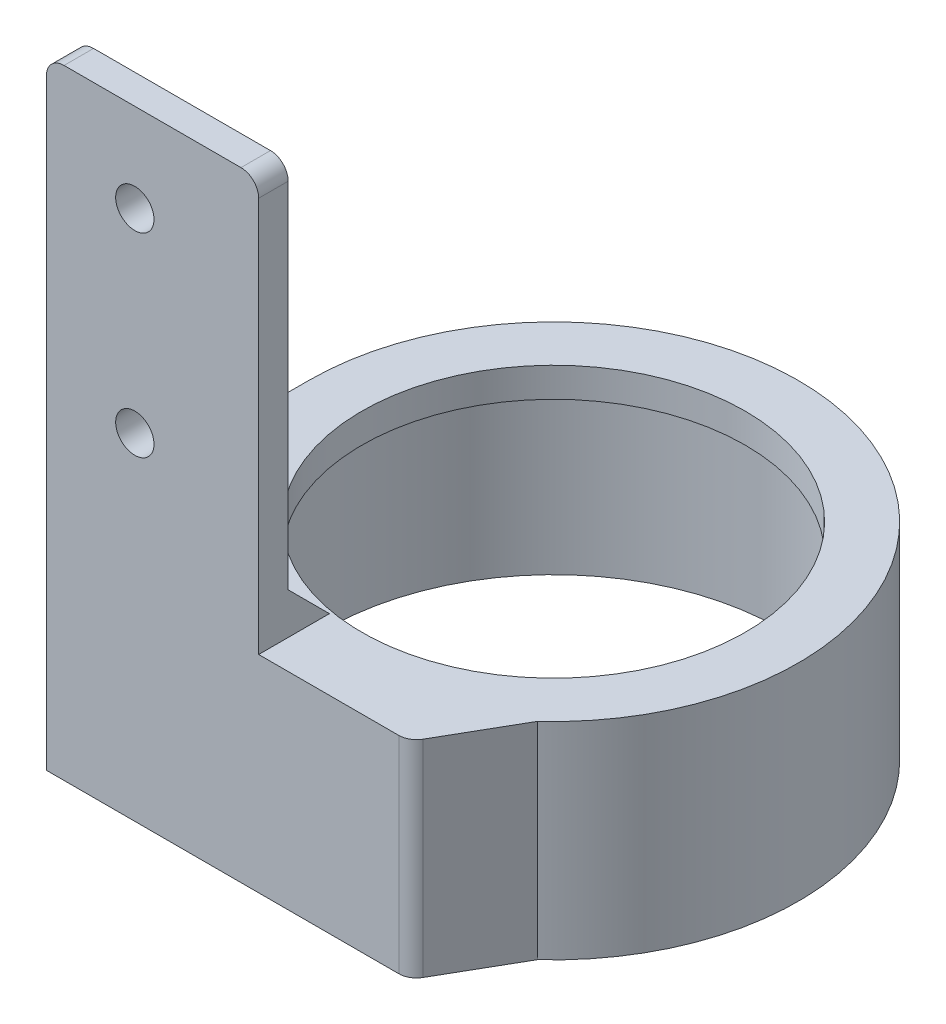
SolidWorks part; units mm, degrees
ref_plane "Ebene vorne" through (0, 0, 0) normal (0, 0, 1) x (1, 0, 0)
ref_plane "Ebene oben" through (0, 0, 0) normal (0, 1, 0) x (1, 0, 0)
ref_plane "Ebene rechts" through (0, 0, 0) normal (1, 0, 0) x (0, 0, -1)
sketch "Skizze1" plane through (0, 0, 0) normal (0, 0, 1) x (1, 0, 0)
  line L0 (18, 0) -> (18, -105) construction
  line L1 (3, 0) -> (33, 0)
  line L2 (0, -3) -> (0, -97)
  line L3 (3, -105) -> (33, -105)
  line L4 (36, -3) -> (36, -97)
  line L5 (0, -63) -> (36, -63) construction
  line L6 (33, -105) -> (36, -105)
  line L7 (36, -105) -> (36, -97)
  line L8 (0, -97) -> (0, -105)
  line L9 (0, -105) -> (3, -105)
  circle A2 centre (15, -15) radius 3.25
  circle A3 centre (15, -48) radius 3.25
  arc A6 (3, 0) -> (0, -3) centre (3, -3) ccw
  arc A7 (33, 0) -> (36, -3) centre (33, -3) cw
  point P18 (36, -105)
  point P21 (0, 0)
  point P24 (36, 0)
  dimension "D3" = 15
  dimension "D4" = 15
  dimension "D5" = 6.5
  dimension "D6" = 6.5
  dimension "D7" = 15
  dimension "D1" = 36
  dimension "D2" = 105
  dimension "D8" = 42
  dimension "D9" = 15
extrude "Aufsatz-Linear austragen1" add sketch "Skizze1" along normal blind 3
sketch "Skizze4" plane through (0, -105, 0) normal (0, -1, 0) x (1, 0, 0)
  line L0 (0, 3) -> (36, 3) construction
  line L1 (0, -20.5722) -> (0, 101.0705) construction
  line L2 (41.5, 44.5) -> (-50.319, 44.5) construction
  circle A0 centre (41.5, 44.5) radius 41.5
  point P7 (0, 44.5)
other "AusrichtungGruppe1" parameters "D1"=51.6821, "D2"=82, "D3"=82
extrude "Aufsatz-Linear austragen2" add sketch "Skizze4" against normal blind 35 separate body
sketch "Skizze6" plane through (0, -105, 0) normal (0, -1, 0) x (-1, 0, 0)
  circle A0 centre (-41.5, -44.5) radius 38.5
  dimension "D1" = 77
extrude "Schnitt-Linear austragen1" cut sketch "Skizze6" against normal through all
sketch "Skizze7" plane through (0, -70, 0) normal (0, 1, 0) x (1, 0, 0)
  circle A0 centre (41.5, -44.5) radius 32.5
  dimension "D1" = 65
extrude "Linear-Austragen-Dünn1" add sketch "Skizze7" against normal blind 5 thin
sketch "Skizze16" plane through (0, 0, 0) normal (0, 0, -1) x (-1, 0, 0)
  line L0 (0, -70) -> (-83, -70) construction
  line L1 (-36, -105) -> (-61.5, -105)
  line L2 (-36, -105) -> (-36, -70)
  line L3 (-36, -70) -> (-61.5, -70)
  line L4 (-61.5, -105) -> (-61.5, -70)
  dimension "D1" = 25.5
extrude "Aufsatz-Linear austragen3" add sketch "Skizze16" against normal blind 3
sketch "Skizze17" plane through (0, -105, 0) normal (0, -1, 0) x (1, 0, 0)
  line L0 (41.5, 12) -> (41.5, -5.5591) construction
  line L2 (65.4633, 10.6177) -> (69.4531, 13.8263)
  line L3 (61.1577, 7.9511) -> (65.4633, 10.6177)
  line L4 (56.4564, 5.7888) -> (61.1577, 7.9511)
  line L5 (51.631, 4.2556) -> (56.4564, 5.7888)
  line L6 (46.5811, 3.3122) -> (51.631, 4.2556)
  line L7 (46.5811, 3.3122) -> (41.5, 3)
  line L8 (0, 3) -> (61.5, 3) construction
  line L10 (61.5, 3) -> (41.5, 3)
  line L11 (69.4531, 13.8263) -> (61.5, 0)
  line L12 (61.5, 0) -> (61.5, 3)
  line L13 (41.5, 3) -> (61.5, 3)
  circle A0 centre (41.5, 44.5) radius 32.5 construction
  circle A1 centre (41.5, 44.5) radius 41.5 construction
  point P10 (46.5811, 3.3122)
  point P11 (51.631, 4.2556)
  point P12 (56.4564, 5.7888)
  point P13 (61.1577, 7.9511)
  point P14 (65.4633, 10.6177)
extrude "Aufsatz-Linear austragen4" add sketch "Skizze17" against normal blind 35
sketch "Skizze19" plane through (0, -105, 0) normal (0, -1, 0) x (1, 0, 0)
  line L2 (0, 44.5) -> (0.2928, 39.5792)
  line L3 (0.2928, 39.5792) -> (1.3201, 34.116)
  line L4 (1.3201, 34.116) -> (2.9875, 29.0393)
  line L5 (2.9875, 29.0393) -> (5.4052, 24.0204)
  line L6 (5.4052, 24.0204) -> (8.4399, 19.4145)
  line L7 (8.4399, 19.4145) -> (12.0006, 15.3103)
  line L8 (12.0006, 15.3103) -> (16.1589, 11.6355)
  line L9 (16.1589, 11.6355) -> (20.6222, 8.6341)
  line L10 (20.6222, 8.6341) -> (25.5345, 6.1939)
  line L11 (25.5345, 6.1939) -> (30.6999, 4.43)
  line L12 (30.6999, 4.43) -> (36.0384, 3.361)
  line L13 (36.0384, 3.361) -> (41.5, 3)
  line L14 (0, 3) -> (0, 44.5)
  line L15 (41.5, 3) -> (0, 3)
  circle A0 centre (41.5, 44.5) radius 41.5 construction
  point P7 (36.0384, 3.361)
  point P10 (30.6999, 4.43)
  point P11 (25.5345, 6.1939)
  point P12 (20.6222, 8.6341)
  point P13 (16.1589, 11.6355)
  point P14 (12.0006, 15.3103)
  point P15 (8.4399, 19.4145)
  point P16 (5.4052, 24.0204)
  point P17 (2.9875, 29.0393)
  point P18 (1.2971, 34.2053)
  point P19 (0.2928, 39.5792)
extrude "Aufsatz-Linear austragen5" add sketch "Skizze19" against normal blind 35
sketch3d "3D-Skizze1"
  point P0 (41.7889, -78.459, 85.999)
ref_plane "Ebene1" through (0, 0, 85.999) normal (0, 0, 1) x (1, 0, 0)
sketch "Skizze20" plane through (0, 0, 85.999) normal (0, 0, 1) x (1, 0, 0)
  line L0 (83, -70) -> (0, -70) construction
  line L3 (0, -105) -> (83, -105) construction
  line L5 (-44.701, -98) -> (109.682, -98) construction
  line L31 (-30.7141, -77) -> (172.708, -77) construction
  line L32 (-23.44, -98) -> (16.56, -98)
  line L57 (16.56, -98) -> (-3.44, -77)
  line L64 (21.56, -77) -> (21.56, -98) construction
  line L65 (-3.44, -77) -> (-23.44, -98)
  line L67 (-3.44, -77) -> (-3.44, -98) construction
  line L74 (21.56, -98) -> (41.56, -77)
  line L75 (41.56, -77) -> (1.56, -77)
  line L76 (1.56, -77) -> (21.56, -98)
  line L90 (66.56, -98) -> (26.56, -98)
  line L91 (26.56, -98) -> (46.56, -77)
  line L92 (46.56, -77) -> (46.56, -98) construction
  line L93 (46.56, -77) -> (66.56, -98)
  line L94 (51.56, -77) -> (91.56, -77)
  line L95 (71.56, -98) -> (51.56, -77)
  line L96 (71.56, -77) -> (71.56, -98) construction
  line L97 (91.56, -77) -> (71.56, -98)
  line L98 (76.56, -98) -> (116.56, -98)
  line L99 (96.56, -77) -> (76.56, -98)
  line L100 (96.56, -77) -> (96.56, -98) construction
  line L101 (116.56, -98) -> (96.56, -77)
  line L102 (141.56, -77) -> (101.56, -77)
  line L103 (101.56, -77) -> (121.56, -98)
  line L104 (121.56, -77) -> (121.56, -98) construction
  line L105 (121.56, -98) -> (141.56, -77)
  line L106 (126.56, -98) -> (141.56, -98)
  line L107 (126.56, -98) -> (146.56, -77)
  line L108 (146.56, -77) -> (146.56, -98)
  line L109 (146.56, -98) -> (141.56, -98)
  dimension "D1" = 7
  dimension "D2" = 40
  dimension "D3" = 5
  dimension "D4" = 7
  dimension "D5" = 5
  dimension "D6" = 40
  dimension "D7" = 5
  dimension "D8" = 5
wrap "Umwickeln1" [suppressed] sketch "Skizze20" source sketch "Skizze20" thickness 5 parameters "D1"=5
sketch "Skizze21" plane through (0, -70, 0) normal (0, 1, 0) x (1, 0, 0)
  line L10 (55.4486, 0) -> (59.7647, 0)
  line L11 (36, 0) -> (61.5, 0) construction
  line L12 (62.3652, -1.5042) -> (64.3465, -4.9487)
  line L13 (69.4531, -13.8263) -> (61.5, 0) construction
  line L14 (64.3465, -4.9487) -> (55.4486, 0)
  line L15 (59.7647, 0) -> (61.5, 0)
  line L16 (61.5, 0) -> (62.3652, -1.5042)
  arc A0 (59.7647, 0) -> (62.3652, -1.5042) centre (59.7647, -3) cw
  point P12 (61.5, 0)
  dimension "D1" = 3
extrude "Schnitt-Linear austragen3" cut sketch "Skizze21" against normal through all contours A0 M4 M3
sketch "Skizze23" plane through (0, 0, 0) normal (0, 0, -1) x (-1, 0, 0)
  line L0 (-15, -15) -> (-15, -48) construction
  line L1 (-36, -70) -> (0, -70) construction
sketch "Skizze24" [suppressed] plane through (0, 0, 0) normal (-1, 0, 0) x (0, 0, 1)
  line L0 (79.7239, -125) -> (0, -125) construction
  line L1 (0, -3) -> (0, -132) construction
  line L2 (0, -74) -> (77.1095, -74) construction
  line L9 (78.7288, -125) -> (44.748, -125) construction
  line L10 (68.2191, -74) -> (86, -74) construction
  line L11 (19.748, -74) -> (59.748, -74)
  line L15 (19.748, -74) -> (39.748, -125)
  line L16 (39.748, -125) -> (59.748, -74)
  line L18 (39.748, -125) -> (39.748, -74) construction
  line L19 (14.748, -74) -> (14.748, -125)
  line L20 (14.748, -74) -> (34.748, -125)
  line L21 (14.748, -125) -> (34.748, -125)
  point P12 (14.748, -74)
  dimension "D1" = 5
  dimension "D2" = 20
  dimension "D3" = 20
  dimension "D4" = 4.2062
  dimension "D5" = 5
  dimension "D6" = 5
extrude "Schnitt-Linear austragen4" [suppressed] cut sketch "Skizze24" against normal blind 15
sketch "Skizze29" plane through (0, 0, 3) normal (0, 0, 1) x (1, 0, 0)
  line L1 (3, 0) -> (33, 0)
  line L2 (0, -3) -> (0, -70)
  line L3 (0, -70) -> (36, -70)
  line L4 (36, -3) -> (36, -70)
  arc A0 (33, 0) -> (36, -3) centre (33, -3) cw
  arc A1 (3, 0) -> (0, -3) centre (3, -3) ccw
  circle A2 centre (15, -15) radius 3.25
  circle A3 centre (15, -48) radius 3.25
  point P10 (0, 0)
  dimension "D1" = 3
extrude "Aufsatz-Linear austragen8" add sketch "Skizze29" along normal blind 2
sketch "Skizze26" plane through (0, 0, 0) normal (-1, 0, 0) x (0, 0, 1)
  line L5 (5, -70) -> (5, -63)
  line L6 (5, -3) -> (5, -70) construction
  line L7 (5, -70) -> (12, -70)
  line L8 (44.5, -70) -> (5, -70) construction
  line L9 (5, -63) -> (12, -70)
  dimension "D1" = 7
  dimension "D2" = 7
extrude "Aufsatz-Linear austragen6" add sketch "Skizze26" against normal blind 36
mirror "Spiegeln1" about plane through (3, -3, 5) normal (0, 0, 1)
delete or keep bodies "Körper-Löschen/beibehalten 1" type delete bodies bodies 120
